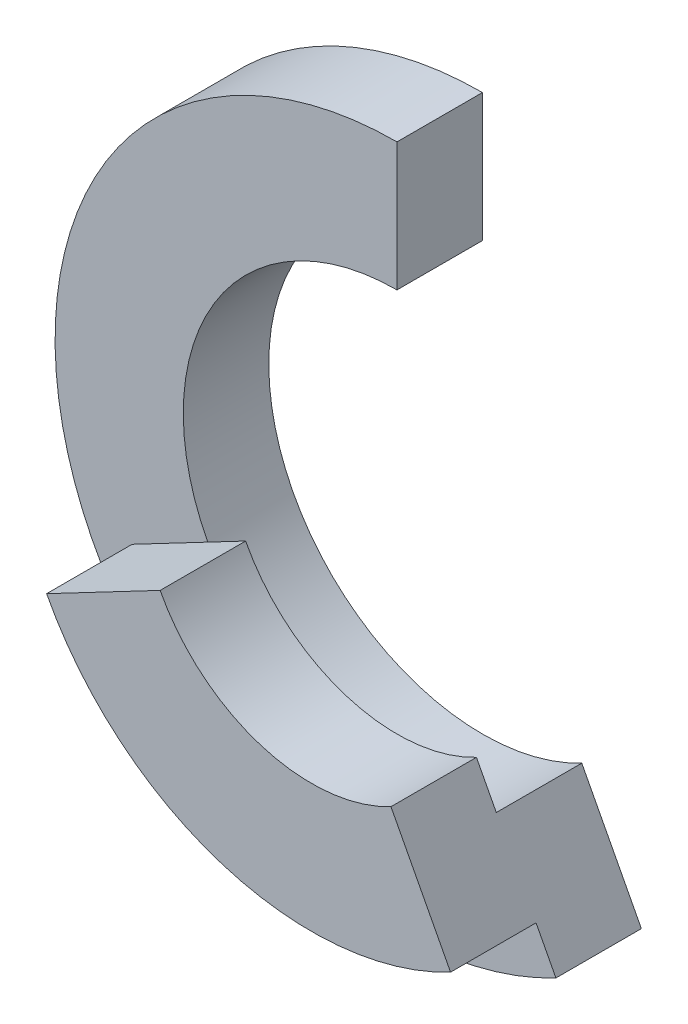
SolidWorks part; units mm, degrees
ref_plane "Front" through (0, 0, 0) normal (0, 0, 1) x (1, 0, 0)
ref_plane "Top" through (0, 0, 0) normal (0, 1, 0) x (1, 0, 0)
ref_plane "Right" through (0, 0, 0) normal (1, 0, 0) x (0, 0, -1)
sketch "Sketch1" plane through (0, 0, 0) normal (0, 0, 1) x (1, 0, 0)
  arc A0 (18.592, -35.4167) -> (0, 40) centre (0, 0) cw
  dimension "D2" = 145
  dimension "D1" = 40
extrude "Extrude-Thin1" add sketch "Sketch1" against normal blind 10 thin
sketch "Sketch4" plane through (0, 0, 0) normal (0, 0, 1) x (1, 0, 0)
  arc A0 (11.62, -22.1354) -> (-22.1354, -11.62) centre (0, 0) cw
  dimension "D1" = 90
extrude "Extrude-Thin2" add sketch "Sketch4" along normal blind 10 thin
